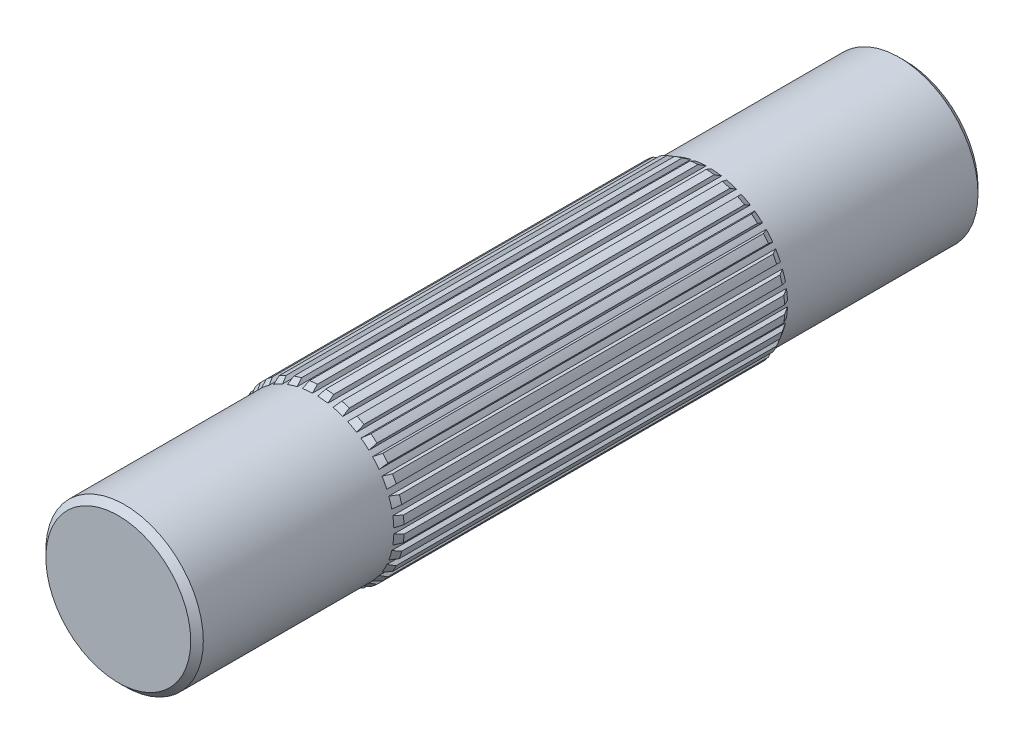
SolidWorks part; units mm, degrees
ref_plane "Front Plane" through (0, 0, 0) normal (0, 0, 1) x (1, 0, 0)
ref_plane "Top Plane" through (0, 0, 0) normal (0, 1, 0) x (1, 0, 0)
ref_plane "Right Plane" through (0, 0, 0) normal (1, 0, 0) x (0, 0, -1)
sketch "Sketch1" plane through (0, 0, 0) normal (0, 0, 1) x (1, 0, 0)
  circle A0 centre (0, 0) radius 3.3274
  dimension "Dia B" = 6.6548
extrude "Boss-Extrude1" add sketch "Sketch1" along normal mid plane 15.875
sketch "Sketch2" plane through (0, 0, 7.9375) normal (0, 0, 1) x (1, 0, 0)
  line L0 (-0.1057, 3.1732) -> (-0.1678, 3.3232)
  line L1 (0.1057, 3.1732) -> (0.1678, 3.3232)
  line L2 (0, 0) -> (-0.1678, 3.3232) construction
  line L3 (0, 0) -> (0.1678, 3.3232) construction
  circle A0 centre (0, 0) radius 3.175 construction
  circle A1 centre (0, 0) radius 3.3274 construction
  arc A2 (0.1678, 3.3232) -> (-0.1678, 3.3232) centre (0, 0) ccw
  arc A3 (-0.1057, 3.1732) -> (0.1057, 3.1732) centre (0, 0) cw
sketch "Sketch3" plane through (0, 0, 0) normal (0, 0, 1) x (1, 0, 0)
  circle A0 centre (0, 0) radius 3.175 construction
  circle A1 centre (0, 0) radius 3.175
extrude "Boss-Extrude2" add sketch "Sketch3" along normal mid plane 31.75
sketch "Sketch4" plane through (0, 0, 0) normal (1, 0, 0) x (0, 0, -1)
  line L0 (-15.875, 3.175) -> (-15.875, 2.921)
  line L1 (-15.875, 2.921) -> (-15.621, 3.175)
  line L2 (-15.621, 3.175) -> (-15.875, 3.175)
  line L3 (-7.9375, 3.3274) -> (-7.9375, 3.175)
  line L4 (-7.9375, 3.175) -> (-7.6735, 3.3274)
  line L5 (-7.6735, 3.3274) -> (-7.9375, 3.3274)
  line L8 (-15.875, 3.175) -> (-15.875, -3.175) construction
  line L9 (0, 0) -> (0, 3.3274) construction
  line L10 (7.6735, 3.3274) -> (7.9375, 3.3274)
  line L11 (7.9375, 3.175) -> (7.6735, 3.3274)
  line L12 (7.9375, 3.3274) -> (7.9375, 3.175)
  line L13 (15.621, 3.175) -> (15.875, 3.175)
  line L14 (15.875, 2.921) -> (15.621, 3.175)
  line L15 (15.875, 3.175) -> (15.875, 2.921)
  line L16 (-7.9375, 3.175) -> (-7.9375, -3.175) construction
  line L17 (7.9375, 3.3274) -> (-7.9375, 3.3274) construction
  dimension "D1" = 30
  dimension "D2" = 45
  dimension "D3" = 0.254
revolve "Cut-Revolve1" cut sketch "Sketch4" angle 360 about axis through (0, 0, 15.875) along (0, 0, -1)
extrude "Cut-Extrude1" cut sketch "Sketch2" against normal through all
pattern_circular "CirPattern1" count 32 over 360 about axis through (0, 0, 0) along (0, 0, 1) of "Cut-Extrude1"
equation "\"D1@CirPattern1\"=(360/\"D1@Sketch2\")-30"
equation "\"D3@Sketch2\"=\"D1@Sketch2\"*.66"
